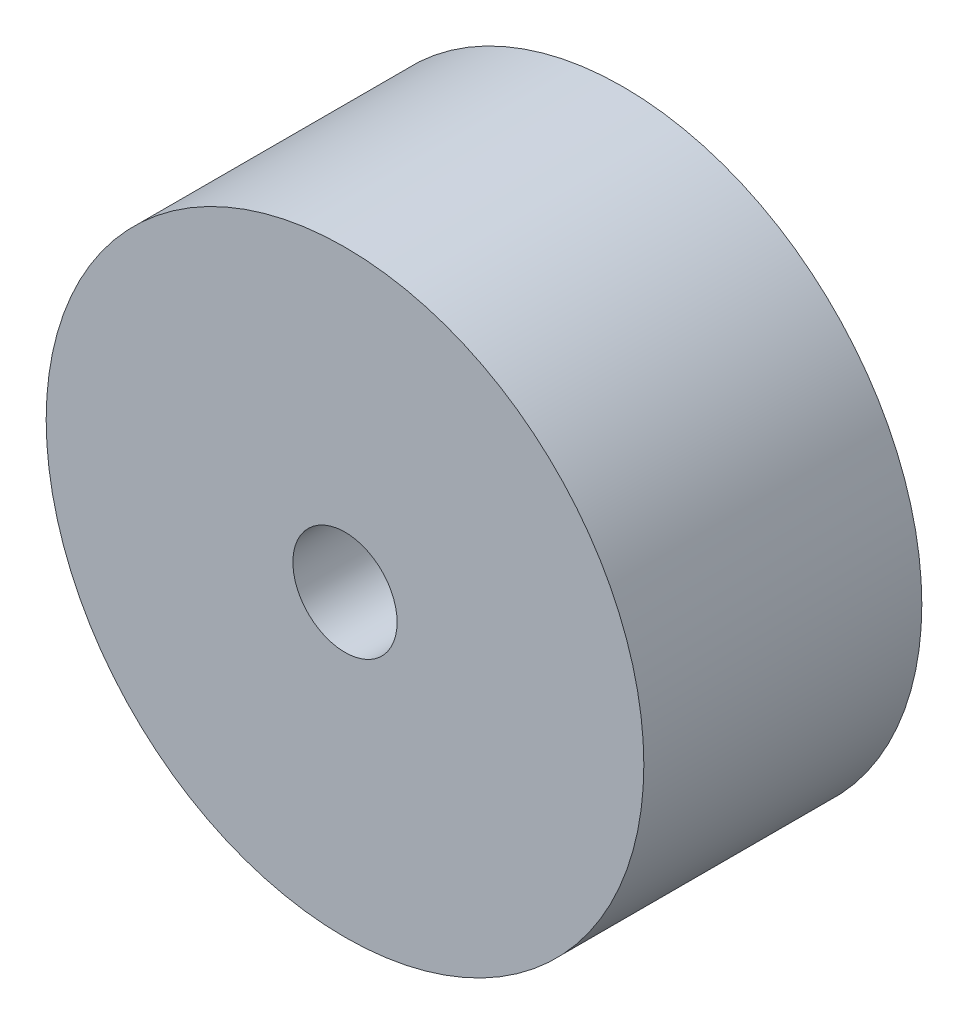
SolidWorks part; units mm, degrees
ref_plane "Face" through (0, 0, 0) normal (0, 0, 1) x (1, 0, 0)
ref_plane "Dessus" through (0, 0, 0) normal (0, 1, 0) x (1, 0, 0)
ref_plane "Droite" through (0, 0, 0) normal (1, 0, 0) x (0, 0, -1)
sketch "Esquisse1" plane through (0, 0, 0) normal (0, 0, 1) x (1, 0, 0)
  circle A0 centre (0, 0) radius 7.5
  circle A1 centre (0, 0) radius 43
  dimension "D1" = 86
  dimension "D2" = 15
extrude "Boss.-Extru.1" add sketch "Esquisse1" along normal blind 40
